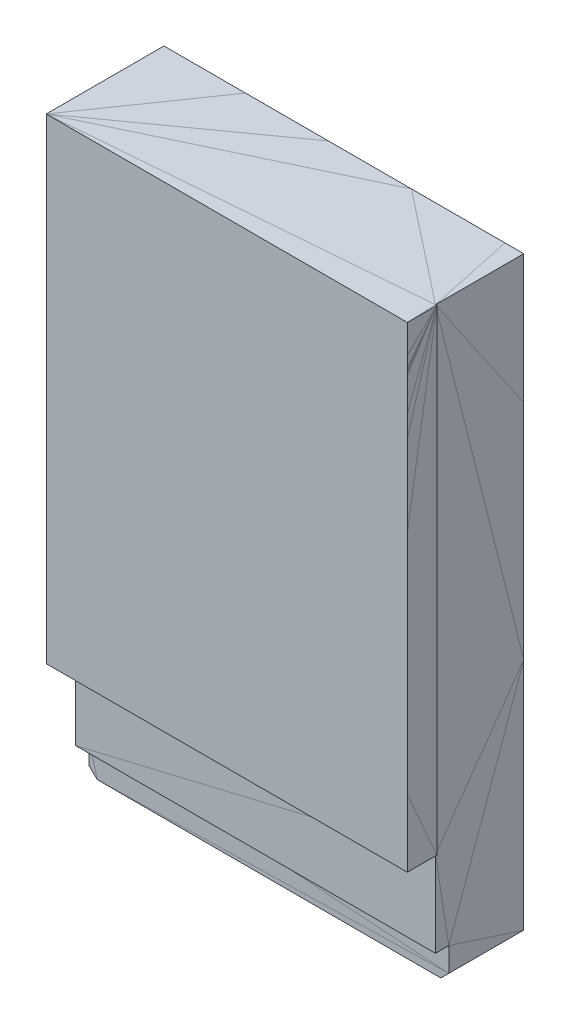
SolidWorks part; units mm, degrees
ref_plane "Front Plane" through (0, 0, 0) normal (0, 0, 1) x (1, 0, 0)
ref_plane "Top Plane" through (0, 0, 0) normal (0, 1, 0) x (1, 0, 0)
ref_plane "Right Plane" through (0, 0, 0) normal (1, 0, 0) x (0, 0, -1)
imported_body "Imported1"
ref_plane "Plane1" through (140, 0, 0) normal (1, 0, 0) x (0, 0, -1)
sketch "Sketch1" plane through (140, 0, 0) normal (1, 0, 0) x (0, 0, -1)
  line L5 (-177.1902, 304.1828) -> (-44, 304.1828)
  line L6 (-177.1902, 304.1828) -> (-177.1902, -40.9259)
  line L7 (-177.1902, -40.9259) -> (-44, -40.9259)
  line L8 (-44, 304.1828) -> (-44, -40.9259)
extrude "Cut-Extrude1" cut sketch "Sketch1" against normal blind 260
sketch "Sketch2" plane through (140, 0, 0) normal (1, 0, 0) x (0, 0, -1)
  line L1 (63.0838, -92.8934) -> (-44, -92.8934)
  line L2 (63.0838, -92.8934) -> (63.0838, 154.0099)
  line L3 (63.0838, 154.0099) -> (-44, 154.0099)
  line L4 (-44, -92.8934) -> (-44, 154.0099)
extrude "Cut-Extrude2" [suppressed] cut sketch "Sketch2" against normal blind 260
